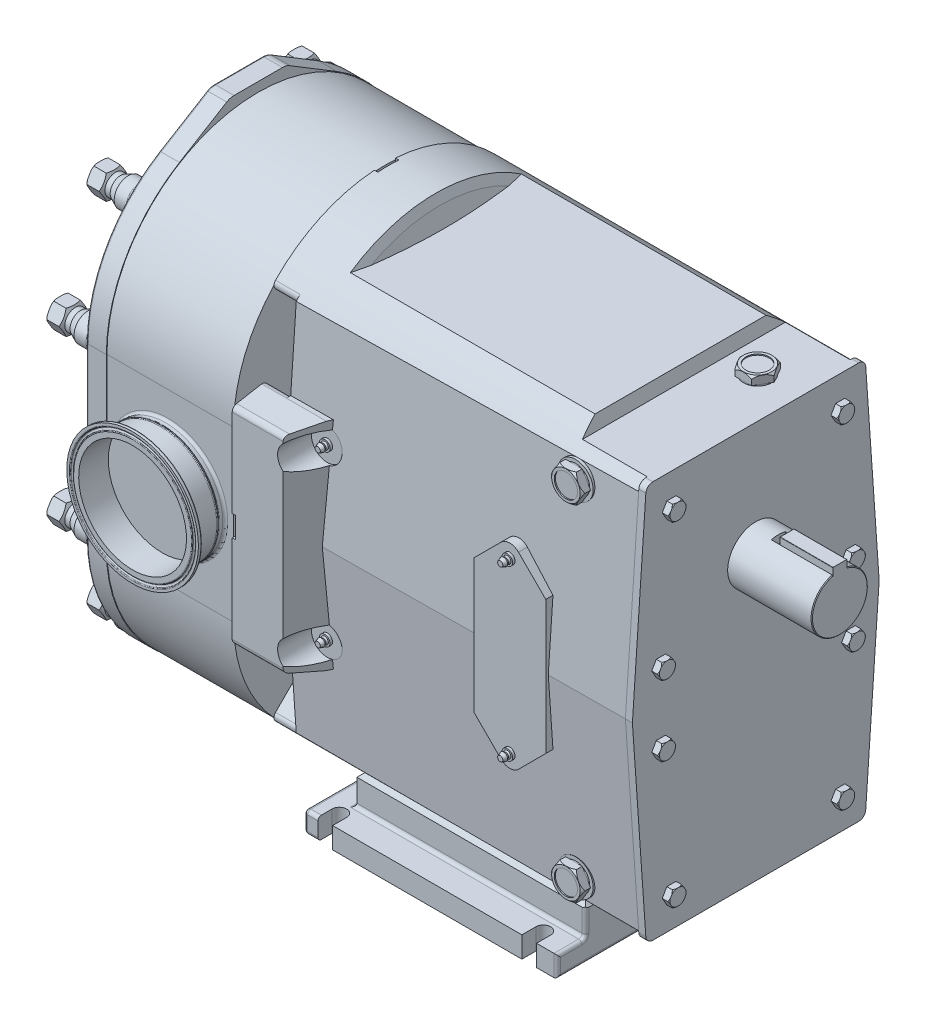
SolidWorks part; units mm, degrees
ref_plane "Front Plane" through (0, 0, 0) normal (0, 0, 1) x (1, 0, 0)
ref_plane "Top Plane" through (0, 0, 0) normal (0, 1, 0) x (1, 0, 0)
ref_plane "Right Plane" through (0, 0, 0) normal (1, 0, 0) x (0, 0, -1)
other "Join1"
other "grease fitting<4>@220_U2_Upper Shaft"
other "grease fitting<2>@220_U2_Upper Shaft"
other "cleanout plug<2>@220_U2_Upper Shaft"
other "oil plug<6>@220_U2_Upper Shaft"
other "oil plug<4>@220_U2_Upper Shaft"
other "108372<8>@220_U2_Upper Shaft"
other "108372<7>@220_U2_Upper Shaft"
other "108372<6>@220_U2_Upper Shaft"
other "108372<4>@220_U2_Upper Shaft"
other "108372<3>@220_U2_Upper Shaft"
other "108372<2>@220_U2_Upper Shaft"
other "Key_220<1>@220_U2_Upper Shaft"
other "Shaft_220<1>@220_U2_Upper Shaft"
other "grease fitting<3>@220_U2_Upper Shaft"
other "grease fitting<1>@220_U2_Upper Shaft"
other "cleanout plug<1>@220_U2_Upper Shaft"
other "oil plug<5>@220_U2_Upper Shaft"
other "oil plug<3>@220_U2_Upper Shaft"
other "oil plug<2>@220_U2_Upper Shaft"
other "oil plug<1>@220_U2_Upper Shaft"
other "plate_220<1>@220_U2_Upper Shaft"
other "108372<5>@220_U2_Upper Shaft"
other "108372<1>@220_U2_Upper Shaft"
other "101851<1>@220_U2_Upper Shaft"
other "220001000S<1>@220_U2_Upper Shaft"
other "230110000<1>@220_U2_Upper Shaft"
other "230005000<1>@220_U2_Upper Shaft"
other "220360009<2>@220_U2_Upper Shaft"
other "220360009<1>@220_U2_Upper Shaft"
